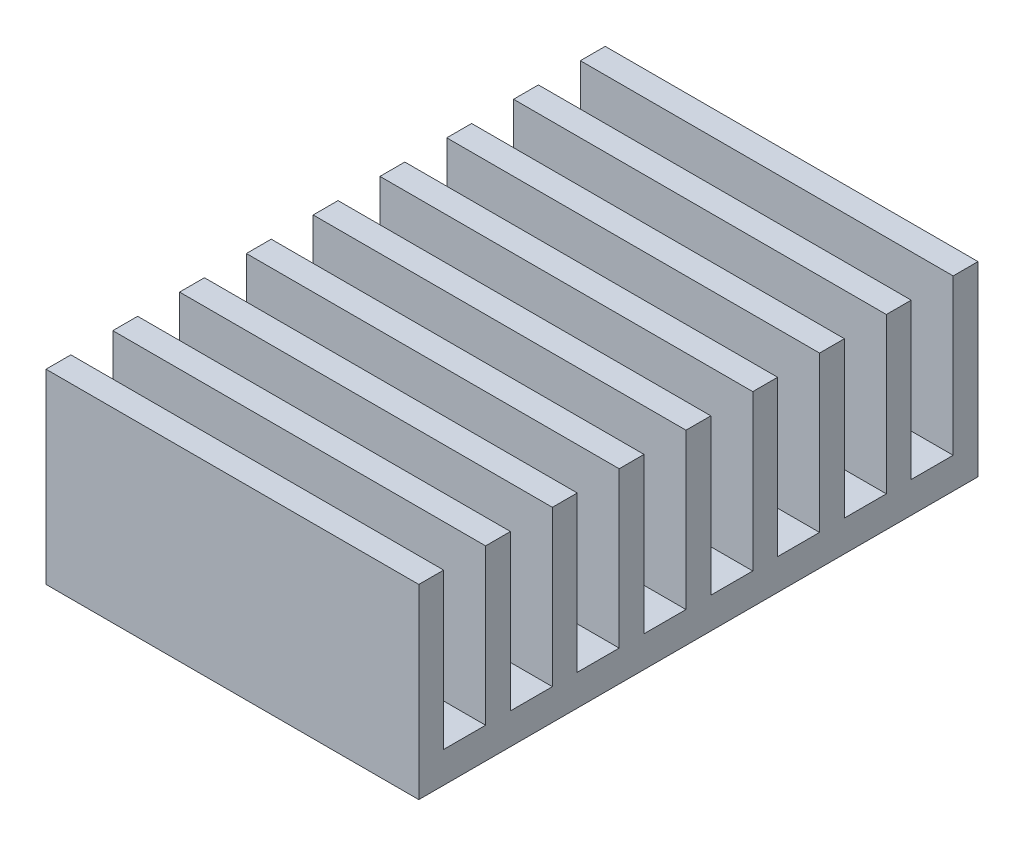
SolidWorks part; units mm, degrees
ref_plane "Front Plane" through (0, 0, 0) normal (0, 0, 1) x (1, 0, 0)
ref_plane "Top Plane" through (0, 0, 0) normal (0, 1, 0) x (1, 0, 0)
ref_plane "Right Plane" through (0, 0, 0) normal (1, 0, 0) x (0, 0, -1)
sketch "Sketch1" plane through (0, 0, 0) normal (1, 0, 0) x (0, 0, -1)
  line L0 (0, 18.7642) -> (0, 0) construction
  line L1 (-22.5, 0) -> (22.5, 0)
  line L2 (22.5, 0) -> (22.5, 15)
  line L3 (22.5, 15) -> (-22.5, 15)
  line L4 (-22.5, 0) -> (-22.5, 15)
  point P7 (0, 15)
  dimension "D1" = 45
  dimension "D2" = 15
extrude "Boss-Extrude1" add sketch "Sketch1" along normal mid plane 30
sketch "Sketch2" plane through (15, 0, 0) normal (1, 0, 0) x (0, 0, -1)
  line L0 (22.5, 15) -> (-22.5, 15) construction
  line L1 (-20.5, 15) -> (-17.125, 15)
  line L2 (-20.5, 15) -> (-20.5, 2.5)
  line L3 (-20.5, 2.5) -> (-17.125, 2.5)
  line L4 (-17.125, 15) -> (-17.125, 2.5)
  line L5 (-20.5, 15) -> (-17.125, 2.5) construction
  line L6 (-20.5, 2.5) -> (-17.125, 15) construction
  line L7 (-22.5, 15) -> (-22.5, 0) construction
  line L8 (-22.5, 0) -> (22.5, 0) construction
  line L9 (-15.125, 15) -> (-11.75, 15)
  line L10 (-15.125, 15) -> (-15.125, 2.5)
  line L11 (-15.125, 2.5) -> (-11.75, 2.5)
  line L12 (-11.75, 15) -> (-11.75, 2.5)
  line L13 (-15.125, 15) -> (-11.75, 2.5) construction
  line L14 (-15.125, 2.5) -> (-11.75, 15) construction
  line L15 (-9.75, 15) -> (-6.375, 15)
  line L16 (-9.75, 15) -> (-9.75, 2.5)
  line L17 (-9.75, 2.5) -> (-6.375, 2.5)
  line L18 (-6.375, 15) -> (-6.375, 2.5)
  line L19 (-9.75, 15) -> (-6.375, 2.5) construction
  line L20 (-9.75, 2.5) -> (-6.375, 15) construction
  line L21 (-4.375, 15) -> (-1, 15)
  line L22 (-4.375, 15) -> (-4.375, 2.5)
  line L23 (-4.375, 2.5) -> (-1, 2.5)
  line L24 (-1, 15) -> (-1, 2.5)
  line L25 (-4.375, 15) -> (-1, 2.5) construction
  line L26 (-4.375, 2.5) -> (-1, 15) construction
  line L27 (1, 15) -> (4.375, 15)
  line L28 (1, 15) -> (1, 2.5)
  line L29 (1, 2.5) -> (4.375, 2.5)
  line L30 (4.375, 15) -> (4.375, 2.5)
  line L31 (1, 15) -> (4.375, 2.5) construction
  line L32 (1, 2.5) -> (4.375, 15) construction
  line L33 (6.375, 15) -> (9.75, 15)
  line L34 (6.375, 15) -> (6.375, 2.5)
  line L35 (6.375, 2.5) -> (9.75, 2.5)
  line L36 (9.75, 15) -> (9.75, 2.5)
  line L37 (6.375, 15) -> (9.75, 2.5) construction
  line L38 (6.375, 2.5) -> (9.75, 15) construction
  line L39 (11.75, 15) -> (15.125, 15)
  line L40 (11.75, 15) -> (11.75, 2.5)
  line L41 (11.75, 2.5) -> (15.125, 2.5)
  line L42 (15.125, 15) -> (15.125, 2.5)
  line L43 (11.75, 15) -> (15.125, 2.5) construction
  line L44 (11.75, 2.5) -> (15.125, 15) construction
  line L45 (17.125, 15) -> (20.5, 15)
  line L46 (17.125, 15) -> (17.125, 2.5)
  line L47 (17.125, 2.5) -> (20.5, 2.5)
  line L48 (20.5, 15) -> (20.5, 2.5)
  line L49 (17.125, 15) -> (20.5, 2.5) construction
  line L50 (17.125, 2.5) -> (20.5, 15) construction
  line L51 (0, 0) -> (0, 20.7644) construction
  line L52 (-22.5, 15) -> (-20.5, 15) construction
  line L53 (-17.125, 15) -> (-15.125, 15) construction
  point P4 (-18.8125, 8.75)
  point P17 (-13.4375, 8.75)
  point P22 (-8.0625, 8.75)
  point P27 (-2.6875, 8.75)
  point P32 (2.6875, 8.75)
  point P37 (8.0625, 8.75)
  point P42 (13.4375, 8.75)
  point P47 (18.8125, 8.75)
  dimension "D1" = 2
  dimension "D2" = 2.5
  dimension "D3" = 8
extrude "Cut-Extrude1" cut sketch "Sketch2" against normal through all
